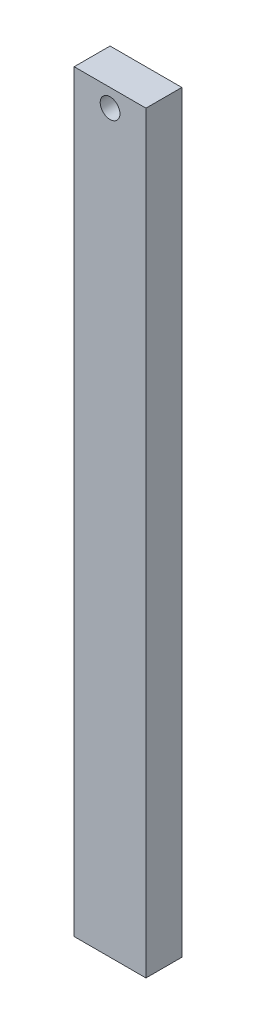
SolidWorks part; units mm, degrees
ref_plane "Спереди" through (0, 0, 0) normal (0, 0, 1) x (1, 0, 0)
ref_plane "Сверху" through (0, 0, 0) normal (0, 1, 0) x (1, 0, 0)
ref_plane "Справа" through (0, 0, 0) normal (1, 0, 0) x (0, 0, -1)
sketch "Эскиз1" plane through (0, 0, 0) normal (0, 0, 1) x (1, 0, 0)
  line L1 (10, 105) -> (-10, 105)
  line L2 (10, 105) -> (10, -105)
  line L3 (10, -105) -> (-10, -105)
  line L4 (-10, 105) -> (-10, -105)
  line L5 (10, 105) -> (-10, -105) construction
  line L6 (10, -105) -> (-10, 105) construction
  point P0 (0, 0)
  dimension "D1" = 210
  dimension "D2" = 20
extrude "Бобышка-Вытянуть1" add sketch "Эскиз1" along normal blind 10
hole_wizard "Отверстие обработанное метчиком M53" positions "Эскиз6" profile "Эскиз7" tap size "M5" standard "ISO"
sketch "Эскиз6" plane through (0, -105, 0) normal (0, -1, 0) x (-1, 0, 0)
  line L0 (10, -10) -> (10, 0) construction
  line L3 (10, -10) -> (-10, -10) construction
  point P2 (0, -5)
  dimension "D1" = 5
  dimension "D2" = 10
sketch "Эскиз7" plane through (0, -105, 5) normal (1, 0, 0) x (0, 0, -1)
  line L0 (0, 0) -> (0, 13.2618)
  line L1 (0, 13.2618) -> (2.1, 12)
  line L2 (2.1, 12) -> (2.1, 0)
  line L5 (2.1, 0) -> (0, 0)
  line L10 (0, 13.2618) -> (-2.1, 12) construction
  line L11 (0, -6.35) -> (0, 107.95) construction
  dimension "Диаметр сверла" = 4.2
  dimension "Глубина сверла" = 12
  dimension "Угол заточки сверла" = 118
hole_wizard "Отверстие с зазором M51" positions "Эскиз8" profile "Эскиз9" hole size "M5" standard "ISO"
sketch "Эскиз8" plane through (0, 0, 10) normal (0, 0, 1) x (1, 0, 0)
  line L0 (10, 105) -> (-10, 105) construction
  line L1 (-10, 105) -> (-10, -105) construction
  point P0 (0, 100)
  dimension "D1" = 5
  dimension "D2" = 10
sketch "Эскиз9" plane through (0, 100, 10) normal (1, 0, 0) x (0, -1, 0)
  line L0 (0, 0) -> (0, 10)
  line L1 (0, 10) -> (2.75, 10)
  line L2 (2.75, 10) -> (2.75, 0)
  line L5 (2.75, 0) -> (0, 0)
  line L11 (0, -6.35) -> (0, 107.95) construction
  dimension "Диаметр сквозного отверстия" = 5.5
  dimension "Глубина сквозного отверстия" = 10
